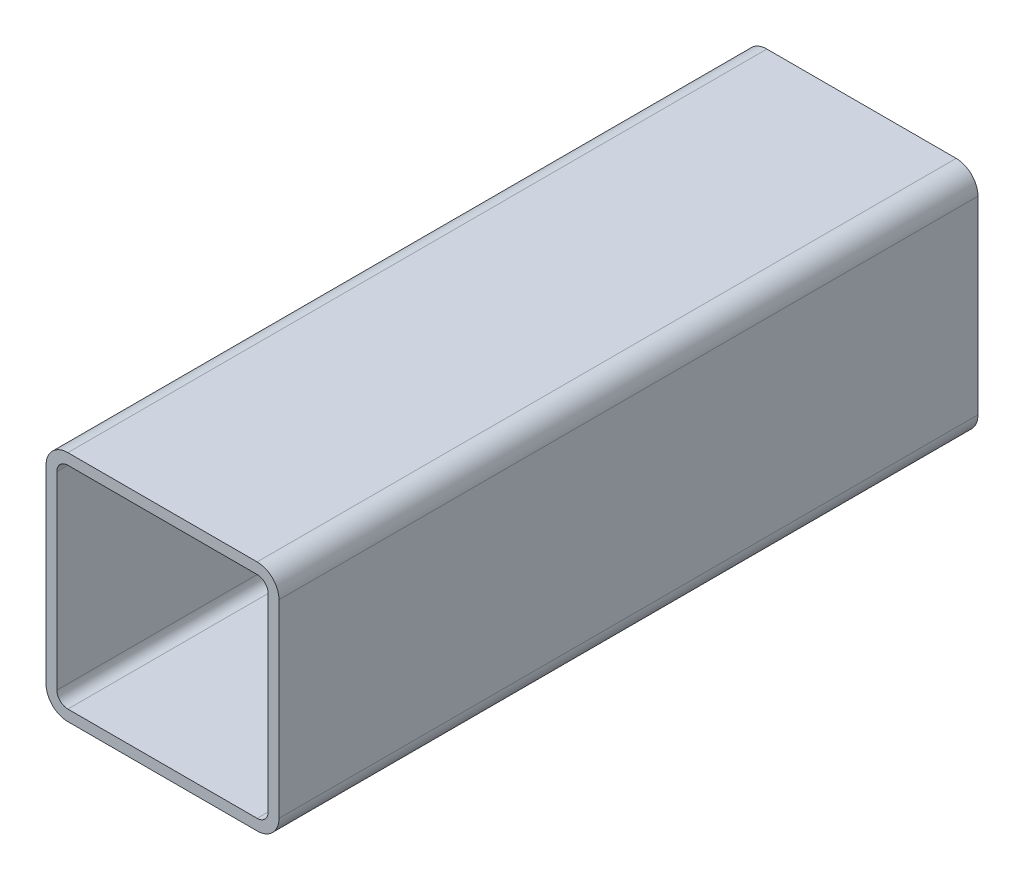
SolidWorks part; units mm, degrees
ref_plane "Front Plane" through (0, 0, 0) normal (0, 0, 1) x (1, 0, 0)
ref_plane "Top Plane" through (0, 0, 0) normal (0, 1, 0) x (1, 0, 0)
ref_plane "Right Plane" through (0, 0, 0) normal (1, 0, 0) x (0, 0, -1)
sketch "Sketch1" plane through (0, 0, 0) normal (0, 0, 1) x (1, 0, 0)
sketch_block_instance "HSS4x4x0.1875-1"
sketch_block "HSS4x4x0.1875"
extrude "Boss-Extrude1" add sketch "Sketch1" along normal blind 304.8
